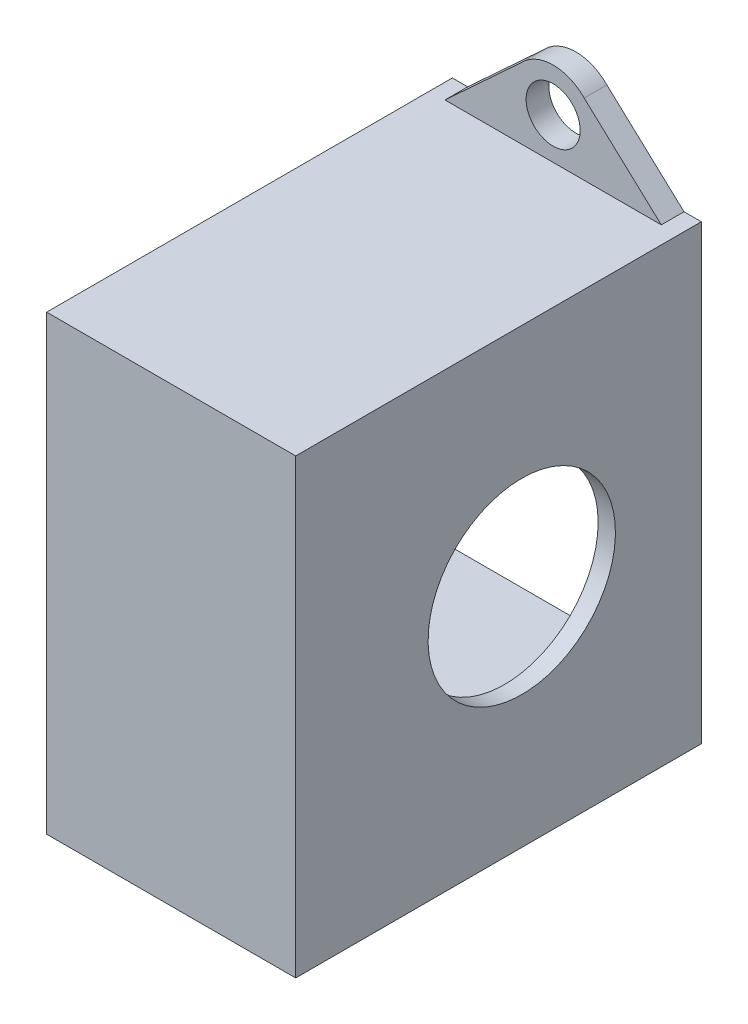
SolidWorks part; units mm, degrees
ref_plane "Front Plane" through (0, 0, 0) normal (0, 0, 1) x (1, 0, 0)
ref_plane "Top Plane" through (0, 0, 0) normal (0, 1, 0) x (1, 0, 0)
ref_plane "Right Plane" through (0, 0, 0) normal (1, 0, 0) x (0, 0, -1)
sketch "Sketch1" plane through (0, 0, 0) normal (0, 0, 1) x (1, 0, 0)
  line L1 (-743.5407, 404.2691) -> (-770.7476, 404.2691)
  line L2 (-743.5407, 404.2691) -> (-743.5407, 351.1831)
  line L3 (-743.5407, 351.1831) -> (-770.7476, 351.1831)
  line L4 (-770.7476, 404.2691) -> (-770.7476, 351.1831)
  dimension "D1" = 53.086
extrude "Boss-Extrude1" add sketch "Sketch1" along normal blind 5.334 contours L1 L4 L3 L2
sketch "Sketch2" plane through (0, 404.2691, 0) normal (0, 1, 0) x (1, 0, 0)
  line L0 (-770.7476, -5.334) -> (-743.5407, -5.334)
  line L1 (-743.5407, -5.334) -> (-770.7476, -5.334) construction
  line L2 (-743.5407, -5.334) -> (-743.5407, 42.291)
  line L3 (-770.7476, -5.334) -> (-770.7476, 42.291)
  line L4 (-770.7476, 42.291) -> (-743.5407, 42.291)
extrude "Boss-Extrude2" add sketch "Sketch2" against normal blind 5.334
sketch "Sketch3" plane through (0, 0, -42.291) normal (0, 0, -1) x (-1, 0, 0)
  line L1 (743.5407, 404.2691) -> (768.9407, 404.2691)
  line L2 (743.5407, 404.2691) -> (752.5939, 412.6317)
  line L3 (743.5407, 404.2691) -> (770.7476, 404.2691) construction
  line L7 (768.9407, 404.2691) -> (759.8875, 412.6317)
  circle A0 centre (756.2407, 409.0951) radius 3.175
  arc A1 (752.5939, 412.6317) -> (759.8875, 412.6317) centre (756.2407, 409.0951) cw
  dimension "D1" = 6.35
extrude "Boss-Extrude3" add sketch "Sketch3" against normal blind 2.667
ref_plane "Plane1" through (0, 377.7261, 0) normal (0, -1, 0) x (-1, 0, 0)
mirror "Mirror1" about plane through (0, 377.7261, 0) normal (0, -1, 0) of "Boss-Extrude2", "Boss-Extrude3"
sketch "Sketch4" plane through (-743.5407, 0, 0) normal (1, 0, 0) x (0, 0, -1)
  line L0 (-5.334, 404.2691) -> (-5.334, 351.1831) construction
  line L1 (-5.334, 404.2691) -> (42.291, 404.2691)
  line L2 (-5.334, 404.2691) -> (-5.334, 351.1831)
  line L3 (-5.334, 351.1831) -> (42.291, 351.1831)
  line L4 (42.291, 404.2691) -> (42.291, 351.1831)
  line L5 (-5.334, 404.2691) -> (39.624, 404.2691) construction
  line L6 (42.291, 346.3571) -> (42.291, 351.1831) construction
  line L7 (42.291, 356.5171) -> (42.291, 351.1831) construction
  circle A1 centre (21.209, 377.7261) radius 10.9982
extrude "Boss-Extrude4" add sketch "Sketch4" along normal up to surface (2.032 mm away)
